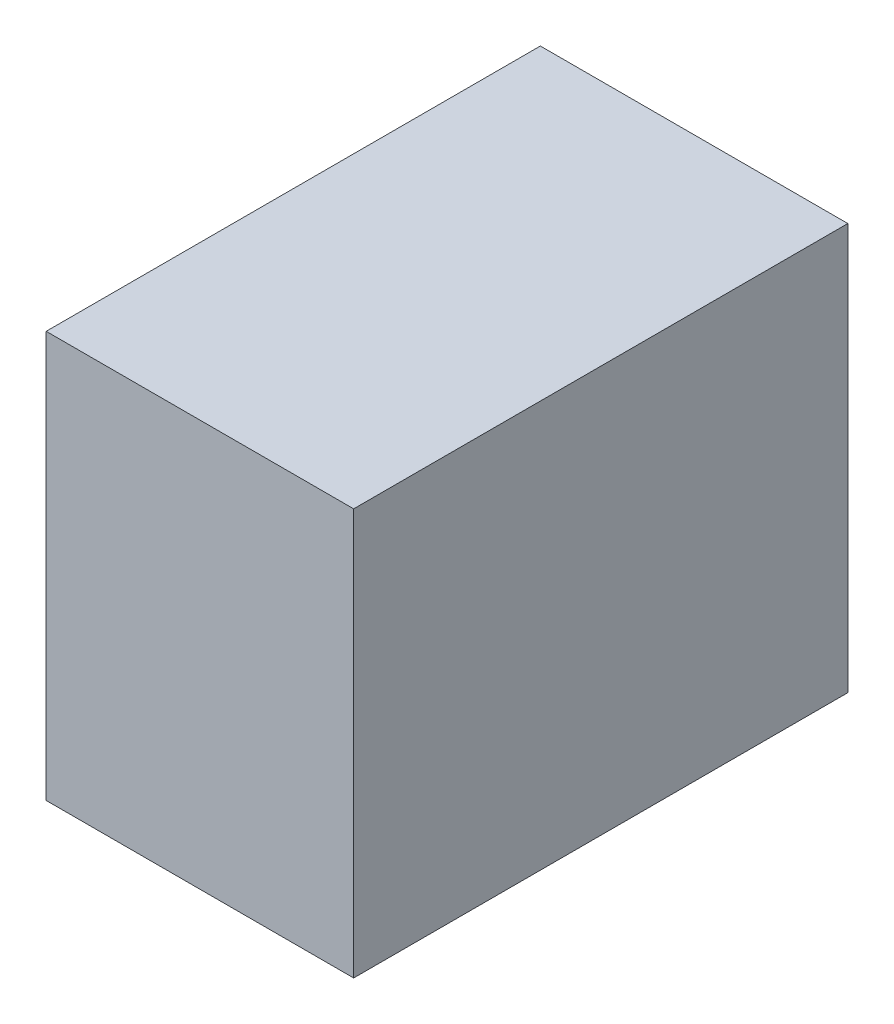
SolidWorks part; units mm, degrees
ref_plane "Front Plane" through (0, 0, 0) normal (0, 0, 1) x (1, 0, 0)
ref_plane "Top Plane" through (0, 0, 0) normal (0, 1, 0) x (1, 0, 0)
ref_plane "Right Plane" through (0, 0, 0) normal (1, 0, 0) x (0, 0, -1)
sketch "Sketch1" plane through (0, 0, 0) normal (0, 0, 1) x (1, 0, 0)
  line L1 (2.9, 33.1383) -> (2.9, -3.8617)
  line L6 (2.9, -3.8617) -> (30.9, -3.8617)
  line L8 (2.9, 33.1383) -> (30.9, 33.1383)
  line L9 (30.9, -3.8617) -> (30.9, 33.1383)
extrude "Boss-Extrude1" add sketch "Sketch1" along normal blind 45
